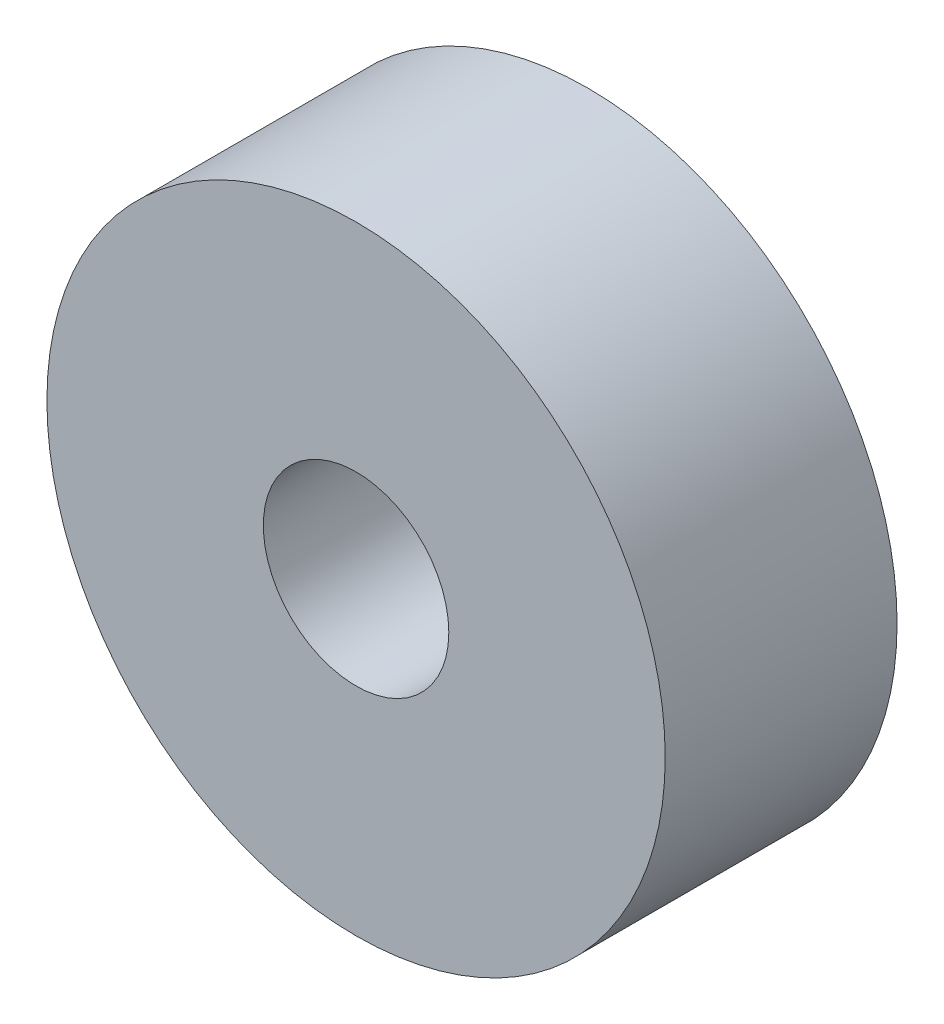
SolidWorks part; units mm, degrees
ref_plane "Front Plane" through (0, 0, 0) normal (0, 0, 1) x (1, 0, 0)
ref_plane "Top Plane" through (0, 0, 0) normal (0, 1, 0) x (1, 0, 0)
ref_plane "Right Plane" through (0, 0, 0) normal (1, 0, 0) x (0, 0, -1)
ref_plane "Plane1"
sketch "Sketch1" plane through (0, 0, 0) normal (0, 0, 1) x (1, 0, 0)
  circle A0 centre (0, 0) radius 20
  circle A1 centre (0, 0) radius 6
  dimension "D1" = 12
  dimension "D2" = 40
extrude "Extrusion1" add sketch "Sketch1" along normal blind 15 contours A0 A1
